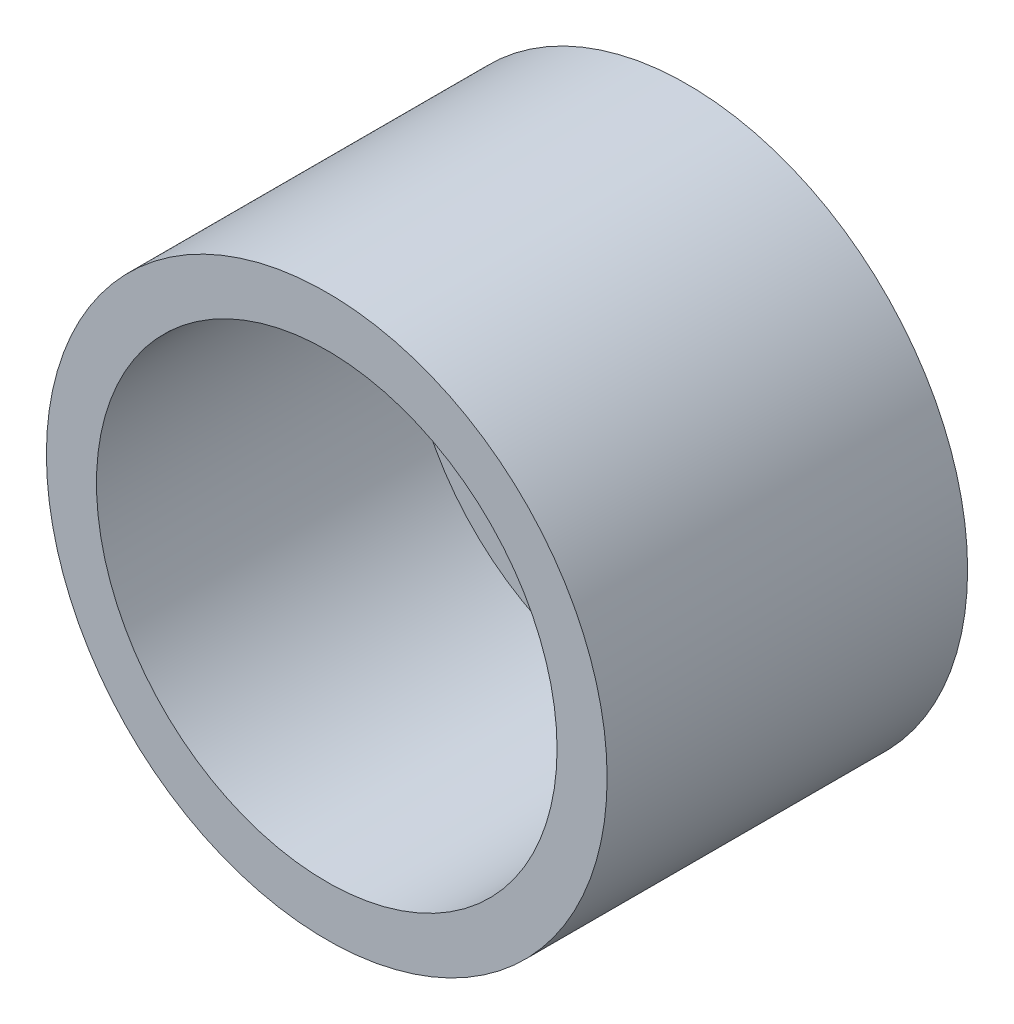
SolidWorks part; units mm, degrees
ref_plane "Front Plane" through (0, 0, 0) normal (0, 0, 1) x (1, 0, 0)
ref_plane "Top Plane" through (0, 0, 0) normal (0, 1, 0) x (1, 0, 0)
ref_plane "Right Plane" through (0, 0, 0) normal (1, 0, 0) x (0, 0, -1)
sketch "Sketch1" plane through (0, 0, 0) normal (0, 0, 1) x (1, 0, 0)
  circle A0 centre (0, 0) radius 14
  dimension "D1" = 28
extrude "Boss-Extrude1" add sketch "Sketch1" along normal blind 18
shell "Shell1" thickness 2.5
